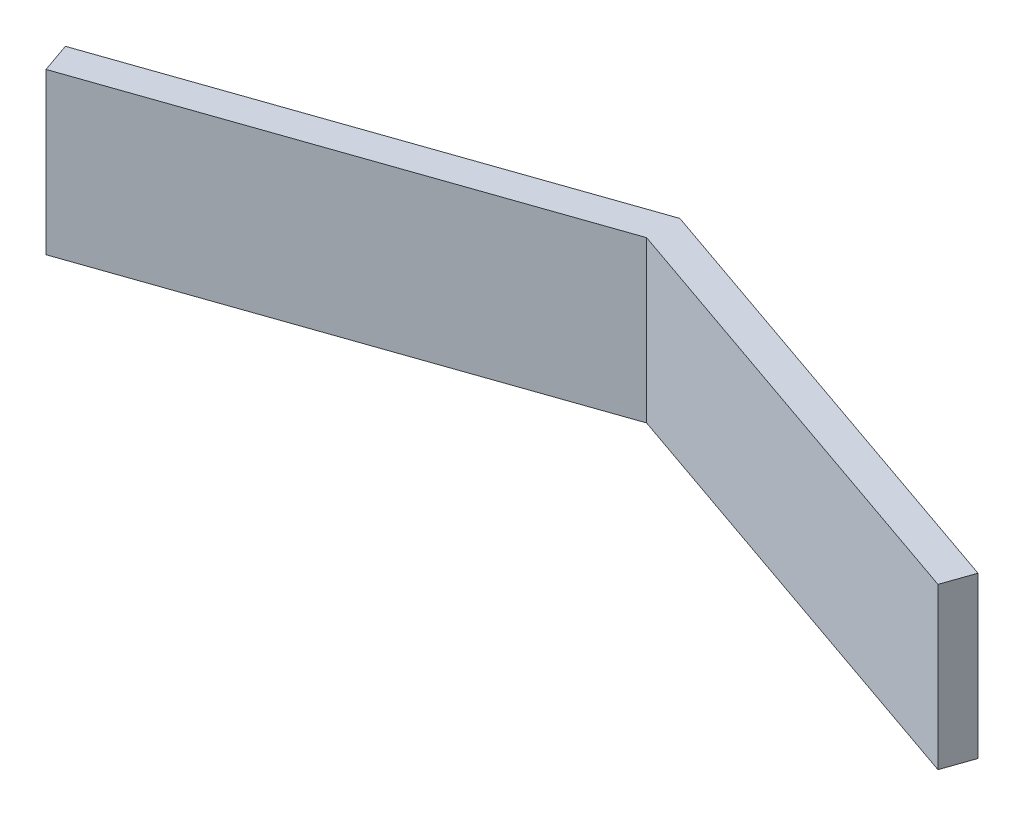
SolidWorks part; units mm, degrees
ref_plane "Alzado" through (0, 0, 0) normal (0, 0, 1) x (1, 0, 0)
ref_plane "Planta" through (0, 0, 0) normal (0, 1, 0) x (1, 0, 0)
ref_plane "Vista lateral" through (0, 0, 0) normal (1, 0, 0) x (0, 0, -1)
sketch "Croquis2" plane through (0, 0, 0) normal (0, 1, 0) x (1, 0, 0)
  line L0 (0, 155.8767) -> (0, -155.8767) construction
  line L1 (-289.4925, 0) -> (289.4925, 0) construction
  line L2 (-141.7254, 0) -> (0, 49.1315)
  line L3 (0, 59.7153) -> (-145.0009, 9.4484)
  line L5 (141.7254, 0) -> (0, 49.1315)
  line L6 (0, 59.7153) -> (145.0009, 9.4484)
  line L8 (141.7254, 0) -> (145.0009, 9.4484)
  line L9 (-141.7254, 0) -> (-145.0009, 9.4484)
  point P4 (0, 0)
  point P8 (0, 0)
  dimension "D1" = 150
  dimension "D2" = 19.12
  dimension "D3" = 10
extrude "Saliente-Extruir1" add sketch "Croquis2" along normal mid plane 51
